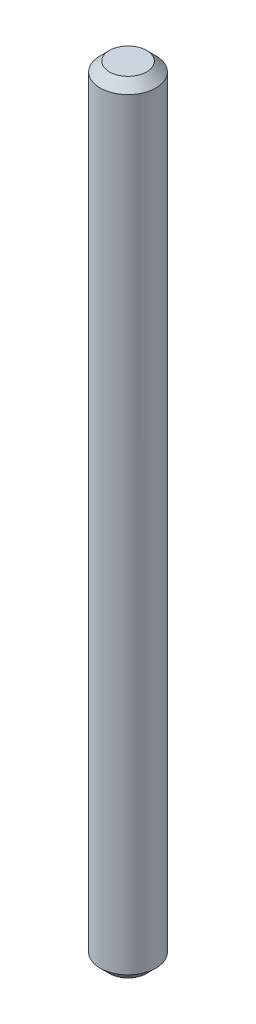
SolidWorks part; units mm, degrees
ref_plane "Спереди" through (0, 0, 0) normal (0, 0, 1) x (1, 0, 0)
ref_plane "Сверху" through (0, 0, 0) normal (0, 1, 0) x (1, 0, 0)
ref_plane "Справа" through (0, 0, 0) normal (1, 0, 0) x (0, 0, -1)
sketch "Эскиз1" plane through (0, 0, 0) normal (0, 1, 0) x (1, 0, 0)
  circle A0 centre (0, 0) radius 0.75
  dimension "D1" = 1.5
extrude "Бобышка-Вытянуть1" add sketch "Эскиз1" along normal mid plane 21
chamfer "Фаска1" distance 0.25 angle 45 2 edges at (0, -10.5, 0.75) (0, 10.5, 0.75)
